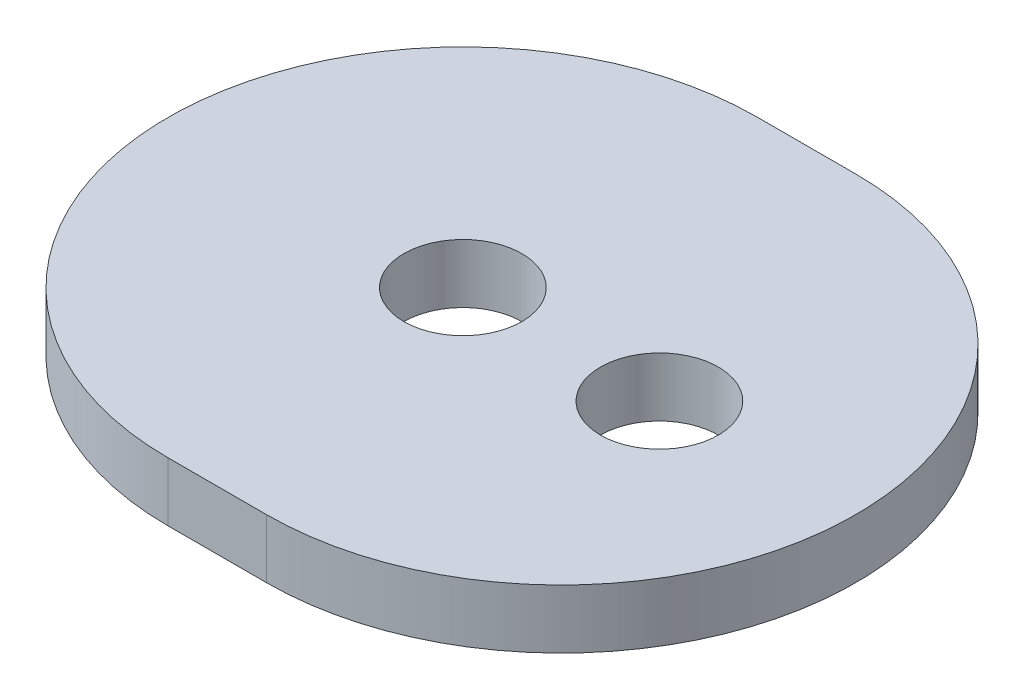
SolidWorks part; units mm, degrees
ref_plane "Front" through (0, 0, 0) normal (0, 0, 1) x (1, 0, 0)
ref_plane "Top" through (0, 0, 0) normal (0, 1, 0) x (1, 0, 0)
ref_plane "Right" through (0, 0, 0) normal (1, 0, 0) x (0, 0, -1)
sketch "Sketch1" plane through (0, 0, 0) normal (0, 1, 0) x (1, 0, 0)
  line L1 (5, -15) -> (0, -15)
  line L3 (5, 15) -> (0, 15)
  circle A0 centre (10, 0) radius 3
  circle A1 centre (0, 0) radius 3
  arc A2 (5, -15) -> (5, 15) centre (5, 0) ccw
  arc A3 (0, 15) -> (0, -15) centre (0, 0) ccw
extrude "Extrude1" add sketch "Sketch1" along normal blind 3
